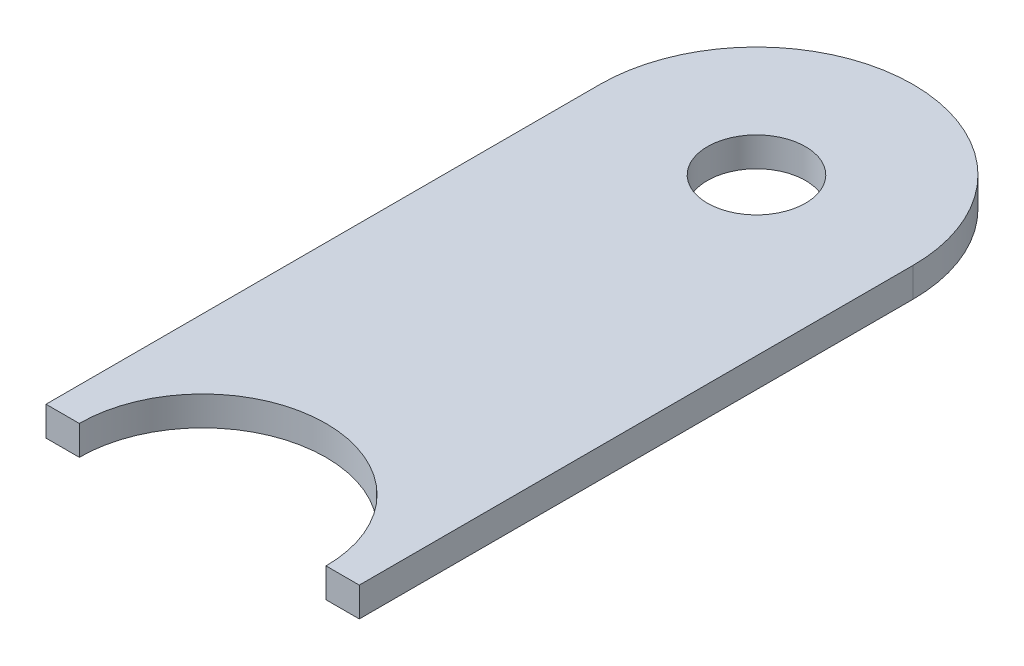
SolidWorks part; units mm, degrees
ref_plane "Front Plane" through (0, 0, 0) normal (0, 0, 1) x (1, 0, 0)
ref_plane "Top Plane" through (0, 0, 0) normal (0, 1, 0) x (1, 0, 0)
ref_plane "Right Plane" through (0, 0, 0) normal (1, 0, 0) x (0, 0, -1)
sketch "Sketch2" plane through (0, 0, 0) normal (0, 1, 0) x (1, 0, 0)
  line L0 (0, 0) -> (0, 56.57)
  line L1 (0, 0) -> (3.4, 0)
  line L2 (32, 0) -> (32, 56.57)
  line L3 (28.6, 0) -> (32, 0)
  circle A0 centre (16, 56.57) radius 5.0084
  arc A1 (32, 56.57) -> (0, 56.57) centre (16, 56.57) ccw
  arc A2 (28.6, 0) -> (3.4, 0) centre (16, 0) ccw
  dimension "D1" = 56.57
  dimension "D4" = 16
  dimension "D5" = 12.6
  dimension "D2" = 16
  dimension "D3" = 32
extrude "Boss-Extrude1" add sketch "Sketch2" along normal blind 3
